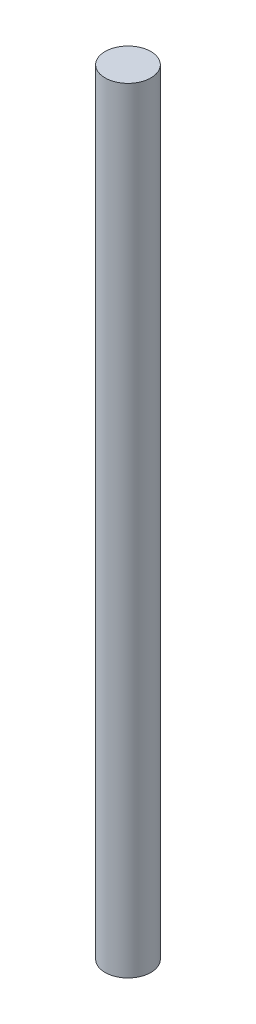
SolidWorks part; units mm, degrees
ref_plane "Front Plane" through (0, 0, 0) normal (0, 0, 1) x (1, 0, 0)
ref_plane "Top Plane" through (0, 0, 0) normal (0, 1, 0) x (1, 0, 0)
ref_plane "Right Plane" through (0, 0, 0) normal (1, 0, 0) x (0, 0, -1)
sketch "Schizzo1" plane through (0, 0, 0) normal (0, 1, 0) x (1, 0, 0)
  circle A0 centre (0, 0) radius 1.95
  dimension "D1" = 3.9
extrude "Estrusione-Estrusione1" add sketch "Schizzo1" along normal blind 66
